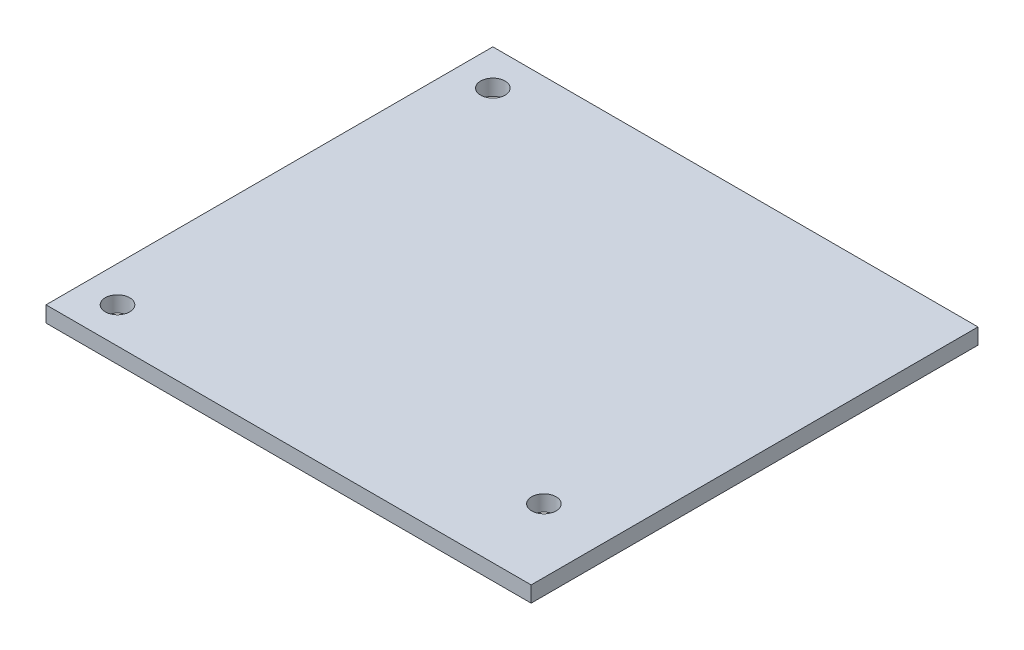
SolidWorks part; units mm, degrees
ref_plane "Front Plane" through (0, 0, 0) normal (0, 0, 1) x (1, 0, 0)
ref_plane "Top Plane" through (0, 0, 0) normal (0, 1, 0) x (1, 0, 0)
ref_plane "Right Plane" through (0, 0, 0) normal (1, 0, 0) x (0, 0, -1)
sketch "Sketch1" plane through (0, 0, 0) normal (0, 1, 0) x (1, 0, 0)
  line L1 (0, 0) -> (48.26, 0)
  line L2 (0, 0) -> (0, 44.45)
  line L3 (0, 44.45) -> (48.26, 44.45)
  line L4 (48.26, 0) -> (48.26, 44.45)
  circle A0 centre (3.556, 40.894) radius 1.2192
  circle A2 centre (3.556, 3.556) radius 1.2192
  circle A3 centre (41.91, 7.62) radius 1.2192
  circle A4 centre (3.556, 40.894) radius 3.175 construction
  dimension "D3" = 2.4384
  dimension "D4" = 6.35
  dimension "D1" = 44.45
  dimension "D2" = 48.26
  dimension "D5" = 3.556
  dimension "D6" = 3.556
  dimension "D7" = 3.556
  dimension "D8" = 6.35
  dimension "D9" = 7.62
extrude "Boss-Extrude1" add sketch "Sketch1" along normal blind 1.5748
sketch "Sketch2" plane through (0, 1.5748, 0) normal (0, 1, 0) x (1, 0, 0)
  circle A0 centre (3.556, 40.894) radius 3.175
  circle A2 centre (41.91, 7.62) radius 3.175
  circle A3 centre (3.556, 3.556) radius 3.175
  dimension "D1" = 6.35
